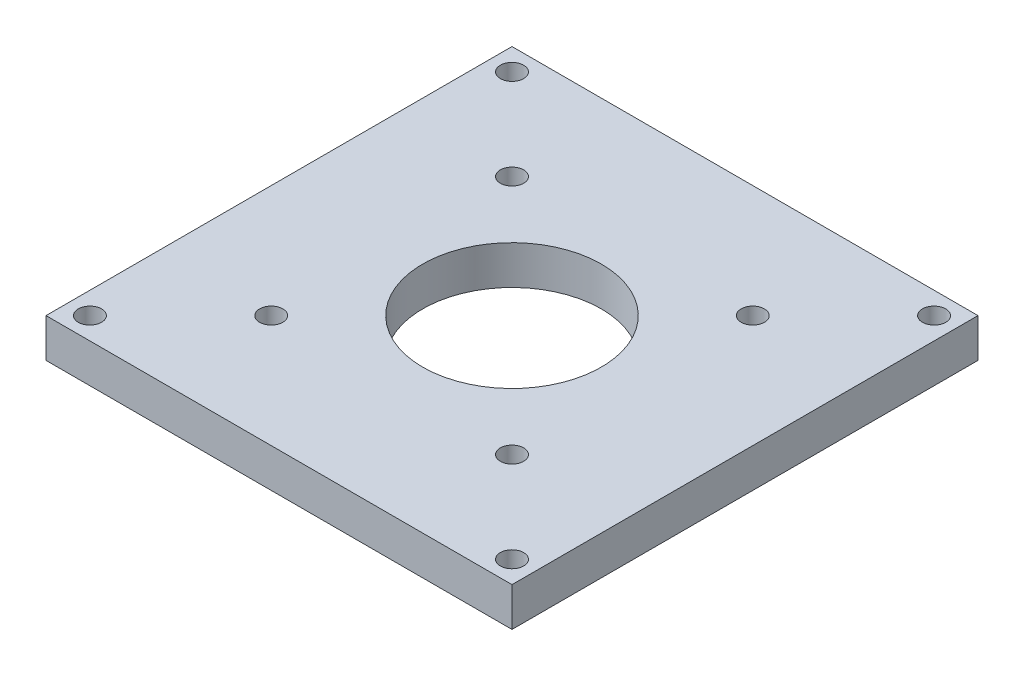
SolidWorks part; units mm, degrees
ref_plane "Front Plane" through (0, 0, 0) normal (0, 0, 1) x (1, 0, 0)
ref_plane "Top Plane" through (0, 0, 0) normal (0, 1, 0) x (1, 0, 0)
ref_plane "Right Plane" through (0, 0, 0) normal (1, 0, 0) x (0, 0, -1)
sketch "Sketch2" plane through (0, 0, 0) normal (0, 1, 0) x (1, 0, 0)
  line L1 (0, 0) -> (60, 0)
  line L2 (0, 0) -> (0, 60)
  line L3 (0, 60) -> (60, 60)
  line L4 (60, 0) -> (60, 60)
  dimension "D1" = 60
  dimension "D2" = 60
extrude "Boss-Extrude1" add sketch "Sketch2" along normal blind 5
sketch "Sketch3" plane through (0, 5, 0) normal (0, 1, 0) x (1, 0, 0)
  line L0 (30, 60) -> (30, 0) construction
  line L1 (60, 60) -> (0, 60) construction
  line L2 (0, 0) -> (60, 0) construction
  line L3 (45.5, 30) -> (14.5, 30) construction
  line L4 (14.5, 45.5) -> (14.5, 14.5) construction
  line L5 (45.5, 45.5) -> (45.5, 14.5) construction
  line L6 (0, 60) -> (2.8284, 57.1716) construction
  line L7 (60, 60) -> (57.1716, 57.1716) construction
  line L8 (60, 0) -> (57.1716, 2.8284) construction
  line L9 (0, 0) -> (2.8284, 2.8284) construction
  line L10 (60, 0) -> (60, 60) construction
  circle A0 centre (30, 30) radius 11.5
  circle A1 centre (14.5, 45.5) radius 1.5
  circle A2 centre (45.5, 45.5) radius 1.5
  circle A3 centre (45.5, 14.5) radius 1.5
  circle A4 centre (14.5, 14.5) radius 1.5
  circle A5 centre (2.8284, 57.1716) radius 1.5
  circle A6 centre (57.1716, 57.1716) radius 1.5
  circle A7 centre (57.1716, 2.8284) radius 1.5
  circle A8 centre (2.8284, 2.8284) radius 1.5
  point P11 (30, 30)
  point P13 (14.5, 30)
  point P16 (45.5, 30)
  dimension "D1" = 23
  dimension "D5" = 3
  dimension "D6" = 3
  dimension "D7" = 3
  dimension "D8" = 3
  dimension "D13" = 3
  dimension "D14" = 3
  dimension "D15" = 3
  dimension "D16" = 3
  dimension "D2" = 31
  dimension "D3" = 31
  dimension "D4" = 31
  dimension "D9" = 4
  dimension "D10" = 4
  dimension "D11" = 4
  dimension "D12" = 4
  dimension "D17" = 45
  dimension "D18" = 45
  dimension "D19" = 45
  dimension "D20" = 45
extrude "Cut-Extrude1" cut sketch "Sketch3" against normal through all
